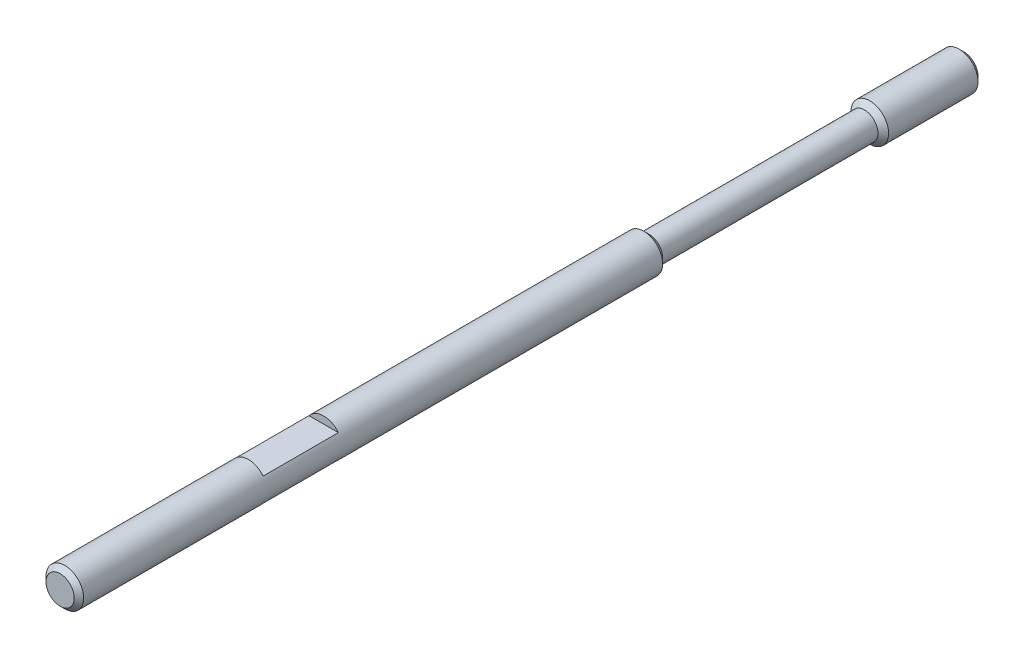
SolidWorks part; units mm, degrees
ref_plane "Front Plane" through (0, 0, 0) normal (0, 0, 1) x (1, 0, 0)
ref_plane "Top Plane" through (0, 0, 0) normal (0, 1, 0) x (1, 0, 0)
ref_plane "Right Plane" through (0, 0, 0) normal (1, 0, 0) x (0, 0, -1)
sketch "Sketch1" plane through (0, 0, 0) normal (1, 0, 0) x (0, 0, -1)
  line L0 (0, 0) -> (-42.5303, 0) construction
  line L1 (0, 0) -> (0, 3.175)
  line L2 (0, 3.175) -> (98.425, 3.175)
  line L3 (152.4, 3.175) -> (152.4, 0)
  line L4 (152.4, 0) -> (0, 0)
  line L5 (98.425, 3.175) -> (99.314, 2.286)
  line L6 (99.314, 2.286) -> (135.636, 2.286)
  line L7 (135.636, 2.286) -> (136.525, 3.175)
  line L8 (136.525, 3.175) -> (152.4, 3.175)
  dimension "D1" = 152.4
  dimension "D2" = 6.35
  dimension "D3" = 15.875
  dimension "D4" = 45
  dimension "D5" = 45
  dimension "D6" = 38.1
  dimension "D7" = 4.572
revolve "Revolve1" add sketch "Sketch1" angle 360 about L0
sketch "Sketch2" plane through (0, 0, 0) normal (1, 0, 0) x (0, 0, -1)
  line L0 (0, 0) -> (57.9747, 0) construction
  line L1 (31.75, 7.0318) -> (44.45, 7.0318)
  line L2 (31.75, 7.0318) -> (31.75, 1.9844)
  line L3 (31.75, 1.9844) -> (44.45, 1.9844)
  line L4 (44.45, 7.0318) -> (44.45, 1.9844)
  line L5 (0, 3.175) -> (0, -3.175) construction
  line L6 (44.45, -7.0318) -> (44.45, -1.9844)
  line L7 (31.75, -1.9844) -> (44.45, -1.9844)
  line L8 (31.75, -7.0318) -> (31.75, -1.9844)
  line L9 (31.75, -7.0318) -> (44.45, -7.0318)
  dimension "D1" = 3.9688
  dimension "D2" = 12.7
  dimension "D3" = 31.75
extrude "Cut-Extrude1" cut sketch "Sketch2" against normal mid plane 15.875
chamfer "Chamfer1" distance 0.7937 angle 45 2 edges at (-3.175, 0, 0) (-3.175, 0, -152.4)
